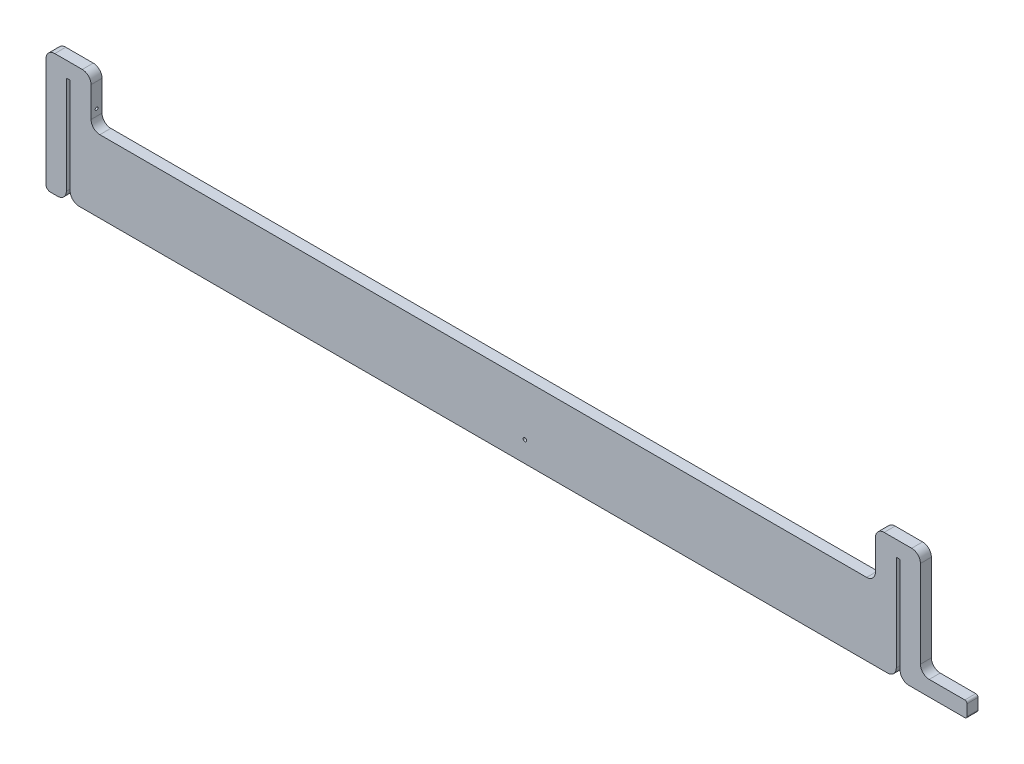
SolidWorks part; units mm, degrees
ref_plane "Front Plane" through (0, 0, 0) normal (0, 0, 1) x (1, 0, 0)
ref_plane "Top Plane" through (0, 0, 0) normal (0, 1, 0) x (1, 0, 0)
ref_plane "Right Plane" through (0, 0, 0) normal (1, 0, 0) x (0, 0, -1)
sketch "Pnl Up/Dwn" plane through (0, 0, 0) normal (0, 0, 1) x (1, 0, 0)
  line L0 (-598.4875, 0) -> (598.4875, 0)
  line L1 (-598.4875, 12.7) -> (-598.4875, 152.4)
  line L2 (598.4875, 152.4) -> (598.4875, 12.7)
  line L3 (611.1875, 0) -> (712.7875, 0)
  line L4 (-588.9625, 3.175) -> (-487.3625, 3.175)
  line L5 (598.4875, 152.4) -> (601.6625, 152.4)
  line L6 (601.6625, 152.4) -> (601.6625, 22.2371)
  line L7 (-598.4875, 152.4) -> (-601.6625, 152.4)
  line L8 (-601.6625, 152.4) -> (-601.6625, 18.7263)
  line L9 (712.7875, 0) -> (712.7875, 3.175)
  line L10 (712.7875, 3.175) -> (612.3342, 3.175)
  line L11 (601.1853, 64.8017) -> (627.4362, 64.8017)
  line L12 (598.9519, 68.4736) -> (574.1805, 68.4736)
  line L13 (601.1853, 84.3612) -> (632.9353, 84.3612)
  line L14 (598.9519, 86.509) -> (567.2019, 86.509)
  line L15 (601.1853, 64.8017) -> (601.1853, 84.3612)
  line L16 (598.9519, 68.4736) -> (598.9519, 86.509)
  arc A0 (-598.4875, 12.7) -> (-588.9625, 3.175) centre (-588.9625, 12.7) ccw
  arc A1 (598.4875, 12.7) -> (611.1875, 0) centre (611.1875, 12.7) ccw
  point P2 (0, 0)
  point P21 (600.075, 152.4)
  point P26 (627.4362, 64.8017)
  point P31 (567.2019, 86.509)
  point P32 (632.9353, 84.3612)
  dimension "D2" = 9.525
  dimension "D3" = 12.7
  dimension "D1" = 1196.975
  dimension "D4" = 3.175
  dimension "D5" = 101.6
  dimension "D6" = 101.6
  dimension "D7" = 139.7
  dimension "D8" = 3.175
  dimension "D9" = 3.175
  dimension "D10" = 3.175
  dimension "D11" = 0.4772
  dimension "D12" = 0.4644
  dimension "D13" = 26.2509
  dimension "D14" = 87.5983
  dimension "D15" = 24.7713
  dimension "D16" = 31.75
  dimension "D17" = 31.75
sketch "Cam center location" plane through (0, 0, 0) normal (0, 0, 1) x (1, 0, 0)
  line L0 (-299.2437, -80.2245) -> (-299.2437, 214.7572)
  line L1 (299.2437, -80.2245) -> (299.2437, 214.7572)
  dimension "D1" = 299.2437
  dimension "D2" = 299.2437
sketch "Sketch3" plane through (0, 0, 0) normal (0, 0, 1) x (1, 0, 0)
  line L0 (-584.9937, 3.175) -> (584.9937, 3.175)
  line L1 (-554.7677, 107.95) -> (554.7677, 107.95)
  line L2 (-599.2812, 154.7813) -> (-601.6625, 154.7813)
  line L3 (-603.25, 153.1938) -> (-603.25, 12.8984)
  line L4 (597.6937, 15.875) -> (597.6937, 153.1938)
  line L5 (599.2812, 154.7813) -> (601.6625, 154.7813)
  line L6 (603.25, 153.1938) -> (603.25, 15.875)
  line L7 (-588.9625, 3.175) -> (-487.3625, 3.175) construction
  line L8 (-598.4875, 12.7) -> (-598.4875, 152.4) construction
  line L9 (-597.6937, 15.875) -> (-597.6937, 153.1938)
  line L10 (598.4875, 152.4) -> (598.4875, 12.7) construction
  line L11 (601.6625, 152.4) -> (601.6625, 22.2371) construction
  line L12 (615.95, 3.175) -> (696.9125, 3.175)
  line L13 (-601.6625, 152.4) -> (-601.6625, 18.7263) construction
  line L14 (-567.4677, 164.3063) -> (-567.4677, 120.65)
  line L15 (-580.1677, 177.0063) -> (-619.9632, 177.0063)
  line L16 (-615.95, 0.1984) -> (-626.3132, 0.1984)
  line L17 (-632.6632, 164.3063) -> (-632.6632, 6.5484)
  line L18 (712.7875, 0) -> (712.7875, 3.175) construction
  line L19 (598.4875, 152.4) -> (601.6625, 152.4) construction
  line L20 (567.4678, 120.65) -> (567.4677, 164.3063)
  line L21 (580.1677, 177.0063) -> (619.9632, 177.0063)
  line L22 (632.6632, 164.3063) -> (632.6632, 38.1)
  line L23 (645.3632, 25.4) -> (696.9125, 25.4)
  line L24 (700.0875, 22.225) -> (700.0875, 6.35)
  line L25 (-598.4875, 0) -> (598.4875, 0) construction
  line L26 (712.7875, 3.175) -> (612.3342, 3.175) construction
  arc A0 (-603.25, 12.8984) -> (-615.95, 0.1984) centre (-615.95, 12.8984) cw
  arc A1 (-584.9937, 3.175) -> (-597.6937, 15.875) centre (-584.9937, 15.875) cw
  arc A2 (615.95, 3.175) -> (603.25, 15.875) centre (615.95, 15.875) cw
  arc A3 (584.9937, 3.175) -> (597.6937, 15.875) centre (584.9937, 15.875) ccw
  arc A4 (-632.6632, 6.5484) -> (-626.3132, 0.1984) centre (-626.3132, 6.5484) ccw
  arc A5 (619.9632, 177.0063) -> (632.6632, 164.3063) centre (619.9632, 164.3063) cw
  arc A6 (567.4677, 164.3063) -> (580.1677, 177.0063) centre (580.1677, 164.3063) cw
  arc A7 (-619.9632, 177.0063) -> (-632.6632, 164.3063) centre (-619.9632, 164.3063) ccw
  arc A8 (-567.4677, 164.3063) -> (-580.1677, 177.0063) centre (-580.1677, 164.3063) ccw
  arc A9 (-554.7677, 107.95) -> (-567.4677, 120.65) centre (-554.7677, 120.65) cw
  arc A10 (554.7677, 107.95) -> (567.4678, 120.65) centre (554.7677, 120.65) ccw
  arc A11 (632.6632, 38.1) -> (645.3632, 25.4) centre (645.3632, 38.1) ccw
  arc A12 (696.9125, 3.175) -> (700.0875, 6.35) centre (696.9125, 6.35) ccw
  arc A13 (696.9125, 25.4) -> (700.0875, 22.225) centre (696.9125, 22.225) cw
  arc A14 (601.6625, 154.7813) -> (603.25, 153.1938) centre (601.6625, 153.1938) cw
  arc A15 (597.6937, 153.1938) -> (599.2812, 154.7813) centre (599.2812, 153.1938) cw
  arc A16 (-597.6937, 153.1938) -> (-599.2812, 154.7813) centre (-599.2812, 153.1938) ccw
  arc A17 (-601.6625, 154.7813) -> (-603.25, 153.1938) centre (-601.6625, 153.1938) ccw
  point P62 (700.0875, 3.175)
  point P65 (700.0875, 25.4)
  dimension "D6" = 12.7
  dimension "D14" = 6.35
  dimension "D16" = 12.7
  dimension "D17" = 3.175
  dimension "D18" = 1.5875
  dimension "D1" = 0.7937
  dimension "D2" = 0.7937
  dimension "D3" = 1.5875
  dimension "D4" = 1.5875
  dimension "D5" = 0.1984
  dimension "D7" = 2.3813
  dimension "D8" = 104.775
  dimension "D9" = 30.226
  dimension "D10" = 29.4132
  dimension "D11" = 22.225
  dimension "D12" = 30.226
  dimension "D13" = 29.4132
  dimension "D15" = 15.875
  dimension ".875" = 22.225
extrude "Boss-Extrude1" add sketch "Sketch3" along normal mid plane 15.875
ref_plane "midPlane of Panel" through (60.325, 0, 0) normal (1, 0, 0) x (0, 0, -1)
sketch "Sketch4" plane through (632.6632, 0, 0) normal (1, 0, 0) x (0, 0, -1)
  line L0 (0, 55) -> (0, -55) construction
  line L1 (7.9375, 38.1) -> (7.9375, 164.3063) construction
  line L3 (-31.7453, 76.2) -> (38.4651, 76.2) construction
  line L4 (-7.9375, 164.3063) -> (7.9375, 164.3063) construction
  line L5 (-12.5888, 154.7813) -> (16.6575, 154.7813) construction
  line L6 (16.6575, 154.7813) -> (16.6575, 76.708) construction
  circle A0 centre (0, 76.708) radius 2.0193
  circle A1 centre (0, 81.026) radius 2.0193 construction
  point P6 (2.0193, 76.708)
  dimension "D1" = 4.0386
  dimension "D5" = 4.0386
  dimension "D2" = 5.9182
  dimension "D3" = 1.016
  dimension "D4" = 88.1063
  dimension "D6" = 4.318
  dimension "D7" = 87.5983
  dimension "D8" = 2.3813
sketch "Sketch5" plane through (-632.6632, 0, 0) normal (-1, 0, 0) x (0, 0, 1)
  circle A0 centre (0, 76.708) radius 2.0193
  circle A1 centre (0, 76.708) radius 2.0193 construction
sketch "Sketch6" plane through (567.4678, 0, 0) normal (-1, 0, 0) x (0, 0, 1)
  line L0 (0, -97.2443) -> (0, 97.2443) construction
  line L1 (7.9375, 120.65) -> (-7.9375, 120.65) construction
  circle A0 centre (0, 130.175) radius 2.0193
  point P2 (0, 0)
  point P3 (0, 0)
  point P6 (0, 108.6038)
  point P7 (0, 125.3888)
  dimension "D1" = 4.0386
  dimension "D2" = 9.525
sketch "Sketch7" plane through (-567.4677, 0, 0) normal (1, 0, 0) x (0, 0, -1)
  circle A0 centre (0, 130.175) radius 2.0193
  circle A2 centre (0, 130.175) radius 2.0193 construction
extrude "Cut-Extrude1" [suppressed] cut sketch "Sketch4" against normal blind 34.798
extrude "Cut-Extrude2" [suppressed] cut sketch "Sketch5" against normal blind 34.798
extrude "Cut-Extrude3" cut sketch "Sketch6" against normal blind 30.48
extrude "Cut-Extrude4" cut sketch "Sketch7" against normal blind 30.48
sketch "Sketch8" plane through (0, 0, 0) normal (0, 0, 1) x (1, 0, 0)
  line L0 (60.325, -8.7312) -> (60.325, 8.7312) construction
  line L1 (-584.9937, 3.175) -> (584.9937, 3.175) construction
  circle A0 centre (60.325, 33.3375) radius 2.54
  dimension "D1" = 5.08
  dimension "D2" = 30.1625
extrude "Cut-Extrude5" cut sketch "Sketch8" against normal mid plane 25.4
